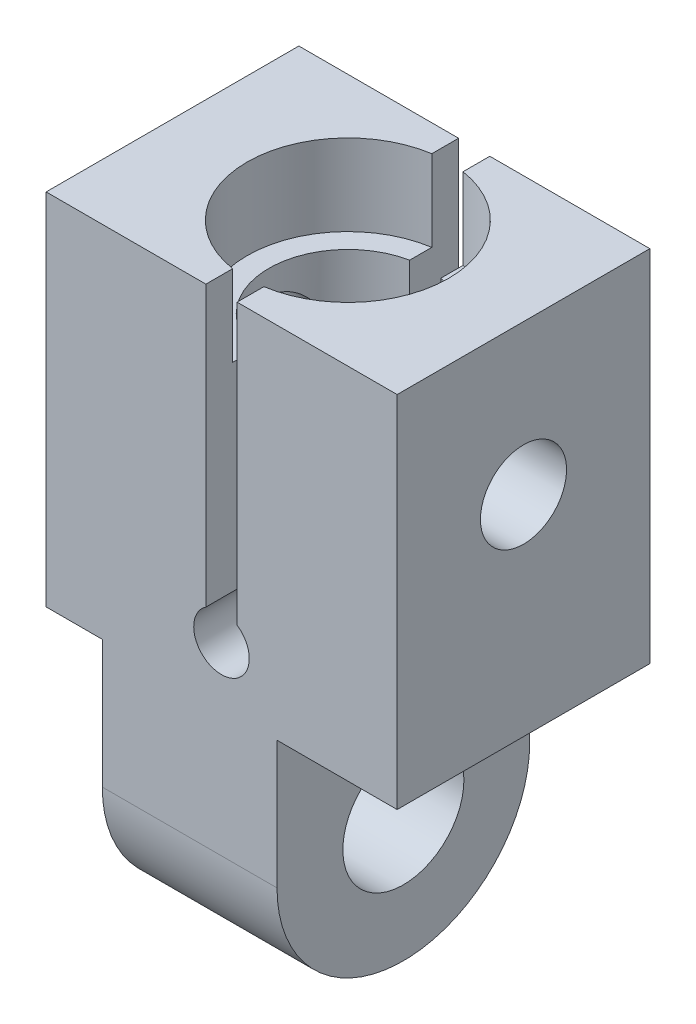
SolidWorks part; units mm, degrees
ref_plane "Спереди" through (0, 0, 0) normal (0, 0, 1) x (1, 0, 0)
ref_plane "Сверху" through (0, 0, 0) normal (0, 1, 0) x (1, 0, 0)
ref_plane "Справа" through (0, 0, 0) normal (1, 0, 0) x (0, 0, -1)
sketch "Эскиз1" plane through (0, 0, 0) normal (1, 0, 0) x (0, 0, -1)
  line L0 (-5.1435, 0) -> (-5.1435, 5.207)
  line L1 (-5.1435, 5.207) -> (5.1435, 5.207)
  line L2 (5.1435, 5.207) -> (5.1435, 0)
  circle A0 centre (0, 0) radius 2.4638
  arc A1 (5.1435, 0) -> (-5.1435, 0) centre (0, 0) cw
  dimension "D1" = 4.9276
  dimension "D2" = 10.287
  dimension "D3" = 5.207
extrude "Бобышка-Вытянуть1" add sketch "Эскиз1" along normal mid plane 7.112
sketch "Эскиз2" plane through (0, 5.207, 0) normal (0, 1, 0) x (1, 0, 0)
  line L0 (3.556, 5.1435) -> (-3.556, 5.1435) construction
  line L1 (-5.842, 5.1435) -> (8.4455, 5.1435)
  line L2 (-5.842, 5.1435) -> (-5.842, -5.1435)
  line L3 (-5.842, -5.1435) -> (8.4455, -5.1435)
  line L4 (8.4455, 5.1435) -> (8.4455, -5.1435)
  line L5 (3.556, -5.1435) -> (-3.556, -5.1435) construction
  line L6 (-3.556, 5.1435) -> (-3.556, -5.1435) construction
  dimension "D1" = 14.2875
  dimension "D2" = 2.286
extrude "Бобышка-Вытянуть2" add sketch "Эскиз2" along normal offset from surface (14.6304 mm away) 19.8374 contours L1 L4 L3 L2
sketch "Эскиз3" plane through (0, 0, 0) normal (1, 0, 0) x (0, 0, -1)
  line L0 (0, 0) -> (0, -5.1435) construction
  line L1 (0, -5.1435) -> (2.667, -5.1435)
  line L2 (2.667, -5.1435) -> (0, -3.6037)
  line L4 (0, -5.1435) -> (0, -3.6037)
  arc A0 (-5.1435, 0) -> (5.1435, 0) centre (0, 0) ccw construction
  dimension "D1" = 60
  dimension "D2" = 5.334
revolve "Вырез-Повернуть1" cut sketch "Эскиз3" angle 360 about L0
sketch "Эскиз4" plane through (0, 0, 5.1435) normal (0, 0, 1) x (1, 0, 0)
  line L0 (-5.842, 19.8374) -> (8.4455, 19.8374) construction
  line L1 (1.9304, 19.8374) -> (0.6604, 19.8374)
  line L2 (1.9304, 19.8374) -> (1.9304, 8.4535)
  line L3 (-5.842, 19.8374) -> (-5.842, 5.207) construction
  line L4 (0.6604, 19.8374) -> (0.6604, 8.4535)
  line L5 (1.2954, 19.8374) -> (1.2954, 4.758) construction
  arc A0 (1.9304, 8.4535) -> (0.6604, 8.4535) centre (1.2954, 7.5184) cw
  dimension "D3" = 1.1303
  dimension "D1" = 7.1374
  dimension "D2" = 1.27
  dimension "D4" = 12.319
extrude "Вырез-Вытянуть1" cut sketch "Эскиз4" against normal through all
sketch "Эскиз6" plane through (0, 0, 0) normal (0, 0, 1) x (1, 0, 0)
  line L0 (1.2954, 20.4167) -> (1.2954, 3.3881) construction
  line L1 (0.6604, 19.8374) -> (0.6604, 8.4535) construction
  line L2 (1.9304, 8.4535) -> (1.9304, 19.8374) construction
  line L3 (-2.8067, 19.8374) -> (1.2954, 19.8374)
  line L4 (1.2954, 19.8374) -> (1.2954, 6.0782)
  line L5 (1.2954, 6.0782) -> (-1.9177, 8.328)
  line L6 (-1.9177, 8.328) -> (-1.9177, 16.5354)
  line L7 (-1.9177, 16.5354) -> (-2.8067, 16.5354)
  line L8 (-2.8067, 16.5354) -> (-2.8067, 19.8374)
  line L9 (-5.842, 19.8374) -> (0.6604, 19.8374) construction
  dimension "D1" = 55
  dimension "D2" = 6.4262
  dimension "D3" = 8.2042
  dimension "D4" = 11.5094
  dimension "D5" = 3.302
revolve "Вырез-Повернуть2" cut sketch "Эскиз6" angle 360 about L0
sketch "Эскиз7" plane through (0, 0, 0) normal (0, 0, 1) x (1, 0, 0)
  line L0 (-9.425, 13.7414) -> (11.7152, 13.7414) construction
  line L1 (8.4455, 13.7414) -> (8.4455, 15.494)
  line L2 (1.9304, 15.5448) -> (-4.2545, 15.5448)
  line L3 (-4.2545, 15.5448) -> (-4.2545, 16.9164)
  line L4 (-4.2545, 16.9164) -> (-5.842, 16.9164)
  line L5 (-5.842, 16.9164) -> (-5.842, 13.7414)
  line L6 (-5.842, 13.7414) -> (8.4455, 13.7414)
  line L7 (1.9304, 15.5448) -> (1.9304, 15.494)
  line L8 (1.9304, 15.494) -> (8.4455, 15.494)
  line L9 (8.4455, 19.8374) -> (8.4455, 5.207) construction
  line L10 (1.9304, 16.5354) -> (1.9304, 19.8374) construction
  line L11 (-5.842, 19.8374) -> (-5.842, 5.207) construction
  line L12 (-5.842, 19.8374) -> (0.6604, 19.8374) construction
  dimension "D1" = 6.35
  dimension "D2" = 3.6068
  dimension "D3" = 6.096
  dimension "D4" = 1.5875
  dimension "D5" = 3.5052
revolve "Вырез-Повернуть3" cut sketch "Эскиз7" angle 360 about L0
